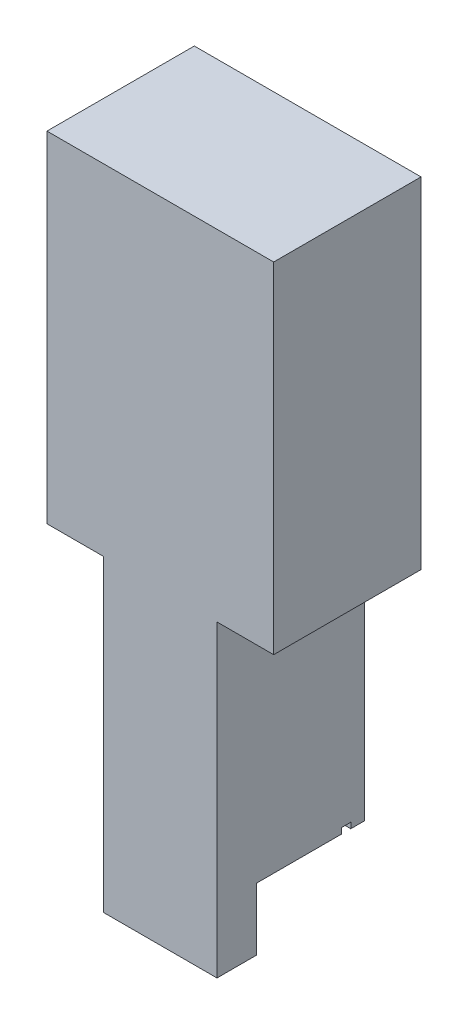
SolidWorks part; units mm, degrees
ref_plane "前视基准面" through (0, 0, 0) normal (0, 0, 1) x (1, 0, 0)
ref_plane "上视基准面" through (0, 0, 0) normal (0, 1, 0) x (1, 0, 0)
ref_plane "右视基准面" through (0, 0, 0) normal (1, 0, 0) x (0, 0, -1)
sketch "草图1" plane through (0, 0, 0) normal (0, 0, 1) x (1, 0, 0)
  line L0 (0, 27.2) -> (0, 57.2)
  line L1 (20, 27.2) -> (20, 57.2)
  line L2 (0, 57.2) -> (20, 57.2)
  line L3 (0, 27.2) -> (5, 27.2)
  line L4 (5, 0) -> (15, 0)
  line L5 (5, 0) -> (5, 27.2)
  line L6 (15, 0) -> (15, 27.2)
  line L7 (15, 27.2) -> (20, 27.2)
extrude "凸台-拉伸1" add sketch "草图1" along normal blind 13
sketch "草图2" plane through (20, 0, 0) normal (1, 0, 0) x (0, 0, -1)
  line L0 (-13, 0) -> (-9.5, 0)
  line L1 (-13, 0) -> (-13, 57.2)
  line L2 (-9.5, 0) -> (-9.5, 5.5)
  line L3 (-13, 57.2) -> (0, 57.2)
  line L4 (0, 5.5) -> (0, 57.2)
  line L5 (-9.5, 5.5) -> (-2, 5.5)
  line L6 (-1.2, 5.5) -> (-1.2, 6)
  line L7 (-2, 5.5) -> (-2, 6)
  line L8 (-2, 6) -> (-1.2, 6)
  line L9 (-1.2, 5.5) -> (0, 5.5)
extrude "切除-拉伸1" cut sketch "草图2" against normal through all flip side to cut
